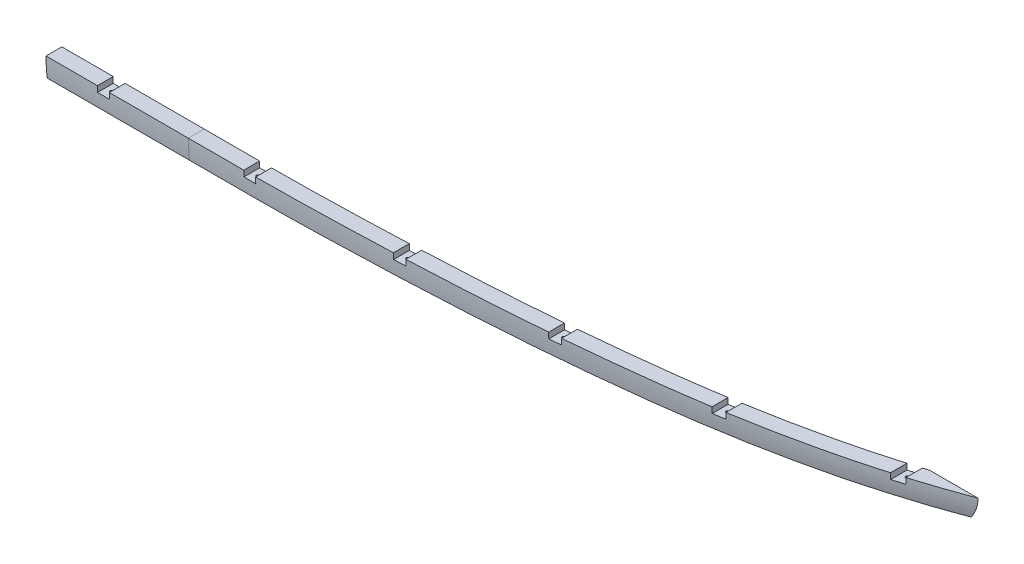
SolidWorks part; units mm, degrees
other "<0 TAIL FLANGE BASE PART>-<#8-32 Tapped Hole2>"
other "<0 TAIL FLANGE BASE PART>-<#8-32 Tapped Hole1>"
ref_plane "FRONT" through (0, 0, 0) normal (0, 0, 1) x (1, 0, 0)
ref_plane "TOP" through (0, 0, 0) normal (0, 1, 0) x (1, 0, 0)
ref_plane "SIDE" through (0, 0, 0) normal (1, 0, 0) x (0, 0, -1)
inserted part "0 TAIL FLANGE BASE PART"
